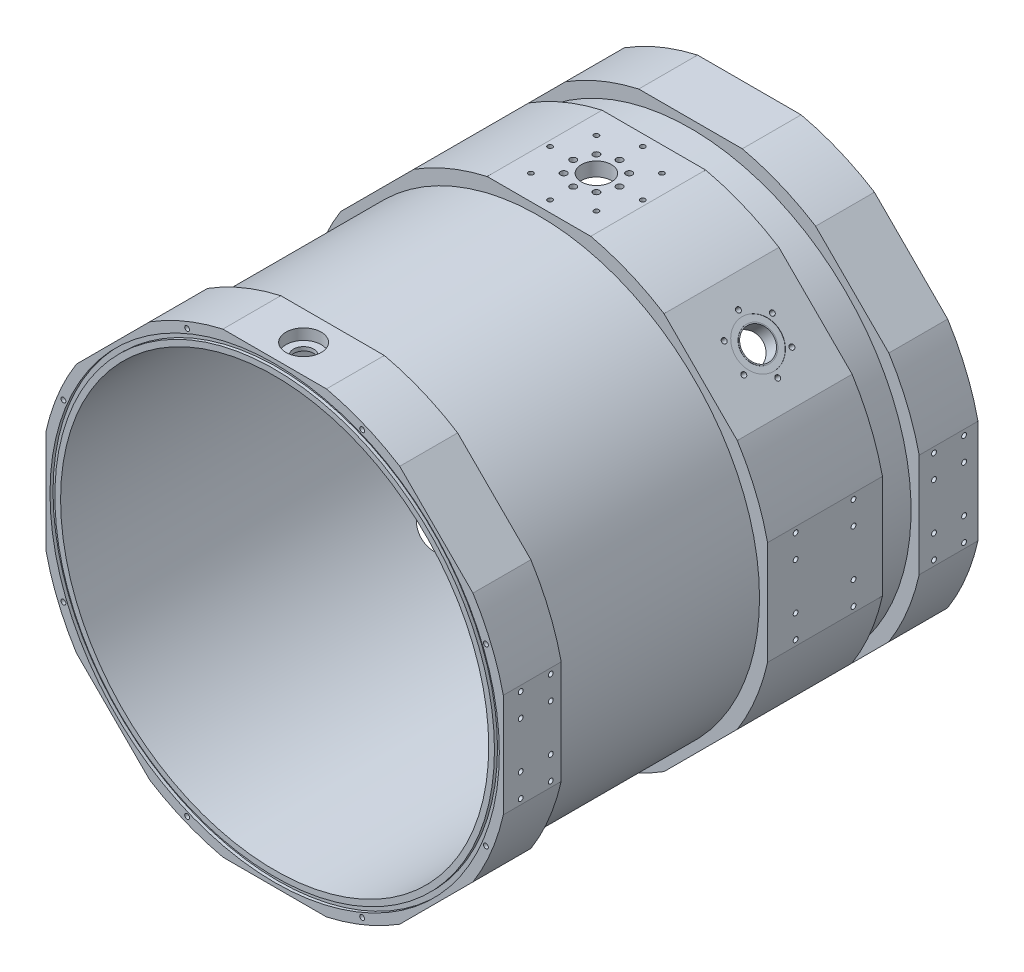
SolidWorks part; units mm, degrees
other "DetailItem1"
other "DetailItem3"
ref_plane "Front Plane" through (0, 0, 0) normal (0, 0, 1) x (1, 0, 0)
ref_plane "Top Plane" through (0, 0, 0) normal (0, 1, 0) x (1, 0, 0)
ref_plane "Right Plane" through (0, 0, 0) normal (1, 0, 0) x (0, 0, -1)
ref_plane "Plane1" through (0, 0, -41.2818) normal (0, 0, 1) x (1, 0, 0)
sketch "Sketch1" plane through (0, 0, 0) normal (0, 0, 1) x (1, 0, 0)
  line L0 (0, 74.0826) -> (0, -98.2025) construction
  line L1 (-101.5333, 0) -> (146.3274, 0) construction
  circle A0 centre (0, 0) radius 202.5
  circle A1 centre (0, 0) radius 184.9
  dimension "D1" = 17.6
  dimension "D2" = 405
extrude "Boss-Extrude1" add sketch "Sketch1" along normal mid plane 410
sketch "Sketch2" plane through (0, 0, 205) normal (0, 0, 1) x (1, 0, 0)
  line L0 (0, 212.952) -> (0, -223.7918) construction
  line L1 (-207.1672, 0) -> (208.5976, 0) construction
  line L2 (197.5, 81.8072) -> (197.5, -81.8072) construction
  line L3 (-197.5, 81.8072) -> (-197.5, -81.8072) construction
  line L4 (-197.5, -81.8072) -> (-81.8072, -197.5) construction
  line L5 (81.8072, -197.5) -> (197.5, -81.8072) construction
  line L6 (81.8072, -197.5) -> (-81.8072, -197.5) construction
  line L7 (-197.5, 81.8072) -> (-81.8072, 197.5) construction
  line L8 (81.8072, 197.5) -> (197.5, 81.8072) construction
  line L9 (81.8072, 197.5) -> (-81.8072, 197.5) construction
  dimension "D1" = 197.5
  dimension "D2" = 197.5
  dimension "D3" = 135
  dimension "D4" = 135
  dimension "D5" = 197.5
sketch "Sketch3" plane through (0, 0, 205) normal (0, 0, 1) x (1, 0, 0)
  line L0 (-44.7214, 197.5) -> (44.7214, 197.5)
  line L1 (108.0308, 171.2764) -> (171.2764, 108.0308)
  line L2 (197.5, 44.7214) -> (197.5, -44.7214)
  line L3 (171.2764, -108.0308) -> (108.0308, -171.2764)
  line L4 (44.7214, -197.5) -> (-44.7214, -197.5)
  line L5 (-108.0308, -171.2764) -> (-171.2764, -108.0308)
  line L6 (-197.5, -44.7214) -> (-197.5, 44.7214)
  line L7 (-171.2764, 108.0308) -> (-108.0308, 171.2764)
  line L9 (-197.5, -81.8072) -> (-81.8072, -197.5) construction
  arc A0 (108.0308, 171.2764) -> (44.7214, 197.5) centre (0, 0) ccw
  arc A1 (-44.7214, 197.5) -> (-108.0308, 171.2764) centre (0, 0) ccw
  arc A2 (-171.2764, 108.0308) -> (-197.5, 44.7214) centre (0, 0) ccw
  arc A3 (-197.5, -44.7214) -> (-171.2764, -108.0308) centre (0, 0) ccw
  arc A4 (-108.0308, -171.2764) -> (-44.7214, -197.5) centre (0, 0) ccw
  arc A5 (44.7214, -197.5) -> (108.0308, -171.2764) centre (0, 0) ccw
  arc A6 (171.2764, -108.0308) -> (197.5, -44.7214) centre (0, 0) ccw
  arc A7 (197.5, 44.7214) -> (171.2764, 108.0308) centre (0, 0) ccw
  dimension "D1" = 405
extrude "Cut-Extrude1" cut sketch "Sketch3" against normal blind 490 flip side to cut
sketch "Sketch4" plane through (0, 0, 205) normal (0, 0, 1) x (1, 0, 0)
  line L1 (81.8072, 197.5) -> (-81.8072, -197.5) construction
  line L2 (81.8072, -197.5) -> (-81.8072, 197.5) construction
  line L3 (197.5, 81.8072) -> (-197.5, -81.8072) construction
  line L4 (-197.5, 81.8072) -> (197.5, -81.8072) construction
  circle A0 centre (0, 0) radius 197.5 construction
  circle A1 centre (-75.58, 182.4662) radius 1.7018
  circle A2 centre (75.58, 182.4662) radius 1.7018
  circle A3 centre (182.4662, 75.58) radius 1.7018
  circle A4 centre (170.1324, -70.4712) radius 1.7018
  circle A5 centre (75.58, -182.4662) radius 1.7018
  circle A6 centre (-75.58, -182.4662) radius 1.7018
  circle A7 centre (-182.4662, 75.58) radius 1.7018
  circle A8 centre (-182.4662, -75.58) radius 1.7018
  circle A9 centre (0, 0) radius 202.5 construction
  dimension "D1" = 3.4036
  dimension "D2" = 5
sketch "Sketch5" plane through (0, 0, 0) normal (0, 1, 0) x (1, 0, 0)
  line L0 (-241.56, 0) -> (278.2282, 0) construction
  line L1 (278.2282, 38.1) -> (-241.56, 38.1) construction
  line L2 (184.9, 33.3375) -> (148.59, 36.5125)
  line L3 (184.9, -205) -> (184.9, 205) construction
  line L4 (148.59, 36.5125) -> (161.29, 36.5125)
  line L5 (161.29, 36.5125) -> (161.29, 39.6875)
  line L6 (161.29, 39.6875) -> (148.59, 39.6875)
  line L7 (148.59, 39.6875) -> (173.99, 42.8625)
  line L8 (173.99, -225.2492) -> (173.99, 235.0092) construction
  line L9 (0, 222.1438) -> (0, -218.5673) construction
  line L10 (184.9, 33.3375) -> (173.99, 42.8625)
  dimension "D1" = 38.1
  dimension "D2" = 3.175
  dimension "D3" = 173.99
  dimension "D4" = 1.5875
  dimension "D5" = 4.7625
  dimension "D6" = 4.7625
  dimension "D7" = 25.4
  dimension "D8" = 12.7
  dimension "D9" = 25.4
sketch "Sketch7" plane through (0, 197.5, 0) normal (0, 1, 0) x (1, 0, 0)
  line L0 (238.7419, 41.2818) -> (-246.5794, 41.2818) construction
  line L1 (0, 219.8326) -> (0, -217.4561) construction
  line L2 (-55, 41.2818) -> (55, 41.2818) construction
  circle A2 centre (0, 41.2818) radius 12.5
  circle A3 centre (0, 41.2818) radius 20 construction
  dimension "D4" = 25
  dimension "D5" = 40
sketch "Sketch8" plane through (0, 197.5, 0) normal (0, 1, 0) x (1, 0, 0)
  line L1 (0, 219.8326) -> (0, -217.4561) construction
  circle A0 centre (0, 61.2818) radius 2.2479
  circle A2 centre (0, 41.2818) radius 20 construction
  dimension "D1" = 4.4958
ref_plane "Plane2" through (0, 0, -179.65) normal (0, 0, -1) x (-1, 0, 0)
sketch "Sketch9" plane through (0, 0, -179.65) normal (0, 0, -1) x (-1, 0, 0)
  circle A0 centre (0, 0) radius 171.9
  circle A1 centre (0, 0) radius 184.9
  circle A2 centre (0, 0) radius 184.9 construction
  dimension "D1" = 13
extrude "Boss-Extrude2" add sketch "Sketch9" along normal blind 15
sketch "Sketch10" plane through (0, 0, -194.65) normal (0, 0, -1) x (-1, 0, 0)
  circle A0 centre (0, 0) radius 176.9 construction
  circle A1 centre (0, 176.9) radius 1.632
  circle A2 centre (0, 0) radius 184.9 construction
  dimension "D1" = 8
  dimension "D2" = 3.2639
ref_plane "Plane3" through (0, 0, 155) normal (0, 0, 1) x (1, 0, 0)
sketch "Sketch11" plane through (0, 0, 155) normal (0, 0, 1) x (1, 0, 0)
  circle A0 centre (0, 0) radius 190.5
  circle A1 centre (0, 0) radius 202.5 construction
  dimension "D1" = 12
extrude "Cut-Extrude7" cut sketch "Sketch11" against normal blind 178.2893 flip side to cut
ref_plane "Plane4" through (0, 0, -154.2) normal (0, 0, -1) x (-1, 0, 0)
sketch "Sketch13" plane through (0, 0, -154.2) normal (0, 0, -1) x (-1, 0, 0)
  circle A0 centre (0, 0) radius 190.5
  circle A1 centre (0, 0) radius 202.5 construction
  dimension "D1" = 12
extrude "Cut-Extrude9" cut sketch "Sketch13" against normal blind 31.7107 flip side to cut
sketch "Sketch17" plane through (0, 197.5, 0) normal (0, 1, 0) x (-1, 0, 0)
  line L0 (0, -92.2113) -> (0, 10.7854) construction
  line L1 (46.1607, -112.9643) -> (-45.5675, -112.9643) construction
  line L2 (-44.7214, -122.4893) -> (44.7214, -122.4893) construction
  dimension "D1" = 9.525
sketch "Sketch20" plane through (-139.6536, 139.6536, 0) normal (-0.7071, 0.7071, 0) x (0, 0, 1)
  line L0 (-213.8582, 0) -> (209.8926, 0) construction
  line L1 (-72.8893, 74.7796) -> (-72.8893, -40.2223) construction
  line L2 (-23.2893, -190.5) -> (-23.2893, 190.5) construction
  line L3 (-122.4893, 190.5) -> (-122.4893, -190.5) construction
  line L4 (-44.0124, -16.6721) -> (-101.7661, 16.6721) construction
  line L5 (-101.7661, -16.6721) -> (-44.0124, 16.6721) construction
  circle A0 centre (-72.8893, 0) radius 13
  circle A1 centre (-72.8893, 0) radius 24.003 construction
  dimension "D1" = 26
  dimension "D4" = 48.006
  dimension "D2" = 30
  dimension "D3" = 30
extrude "Cut-Extrude10" cut sketch "Sketch20" against normal blind 15
sketch "Sketch21" plane through (-139.6536, 139.6536, 0) normal (-0.7071, 0.7071, 0) x (0, 0, 1)
  circle A0 centre (-72.8893, 0) radius 19.304
  circle A1 centre (-72.8893, 0) radius 13.97
  dimension "D1" = 27.94
  dimension "D2" = 5.334
extrude "Cut-Extrude11" cut sketch "Sketch21" against normal blind 0.254
hole_wizard "M5x0.8 Tapped Hole6" positions "3DSketch2" profile "Sketch23" tap size "M5x0.8" standard "Ansi Metric"
sketch3d "3DSketch2"
  line L0 (-86.7765, 192.5307, -72.8893) -> (-168.0951, 111.2121, -72.8893) construction
  line L1 (-151.4425, 127.8647, -101.7661) -> (-127.8647, 151.4425, -44.0124) construction
  line L2 (-151.4425, 127.8647, -44.0124) -> (-127.8647, 151.4425, -101.7661) construction
  circle A0 centre (-139.6536, 139.6536, -72.8893) radius 24.003 construction
  point P0 (-122.6809, 156.6263, -72.8893)
  point P6 (-156.6263, 156.6263, -72.8893)
  point P7 (-148.1399, 131.1672, -93.6765)
  point P11 (-131.1672, 148.1399, -93.6765)
  point P15 (-156.6263, 122.6809, -72.8893)
  point P17 (-148.1399, 131.1672, -93.6765)
  point P19 (-131.1672, 148.1399, -93.6765)
  point P21 (-148.1399, 131.1672, -93.6765)
  point P23 (-131.1672, 148.1399, -93.6765)
  point P31 (-148.1399, 131.1672, -93.6765)
  point P33 (-131.1672, 148.1399, -93.6765)
  point P36 (-131.1672, 148.1399, -93.6765)
  point P38 (-148.1399, 131.1672, -93.6765)
  point P40 (-148.1399, 131.1672, -52.1021)
  point P42 (-131.1672, 148.1399, -52.1021)
sketch "Sketch23" plane through (-122.6809, 156.6263, -72.8893) normal (0, 0, 1) x (-0.7071, -0.7071, 0)
  line L0 (0, 0) -> (0, 8.3738)
  line L1 (0, 8.3738) -> (2.1, 7.112)
  line L2 (2.1, 7.112) -> (2.1, 0)
  line L5 (2.1, 0) -> (0, 0)
  line L10 (0, 8.3738) -> (-2.1, 7.112) construction
  line L11 (0, -6.35) -> (0, 107.95) construction
  dimension "Tap Drill Dia." = 4.2
  dimension "Tap Drill Depth" = 7.112
  dimension "Drill Angle" = 118
mirror "Mirror2" about plane through (0, 0, 0) normal (1, 0, 0) of "M5x0.8 Tapped Hole6", "Cut-Extrude11", "Cut-Extrude10"
sketch "Sketch24" plane through (-139.6536, -139.6536, 0) normal (0.7071, 0.7071, 0) x (0, 0, 1)
  line L0 (-72.8893, 198.5108) -> (-72.8893, -206.1304) construction
  line L1 (-216.7578, 0) -> (226.3825, 0) construction
  line L2 (-23.2893, -190.5) -> (-23.2893, 190.5) construction
  line L3 (-122.4893, -171.2764) -> (-122.4893, -197.5) construction
  circle A0 centre (-72.8893, 0) radius 20.5
  dimension "D1" = 41
extrude "Cut-Extrude12" cut sketch "Sketch24" along normal blind 17
sketch "Sketch25" plane through (-139.6536, -139.6536, 0) normal (0.7071, 0.7071, 0) x (0, 0, 1)
  line L0 (-72.8893, 63.097) -> (-72.8893, -63.629) construction
  line L1 (-93.2399, 0) -> (11.8304, 0) construction
  line L2 (-110.0134, 21.4336) -> (6.9294, -46.0833) construction
  line L3 (0.8647, 42.5818) -> (-102.7952, -17.2662) construction
  circle A0 centre (-72.8893, 0) radius 21.77
  circle A1 centre (-72.8893, 0) radius 27.104
  circle A2 centre (-72.8893, 0) radius 20.5 construction
  circle A3 centre (-72.8893, 0) radius 30.988 construction
  dimension "D1" = 1.27
  dimension "D2" = 5.334
  dimension "D5" = 61.976
  dimension "D3" = 30
  dimension "D4" = 30
extrude "Cut-Extrude13" cut sketch "Sketch25" along normal blind 0.254
hole_wizard "M5x0.8 Tapped Hole7" positions "3DSketch5" profile "Sketch28" tap size "M5x0.8" standard "Ansi Metric"
sketch3d "3DSketch5"
  line L0 (-95.0372, -184.2699, -72.8893) -> (-184.6461, -94.6611, -72.8893) construction
  line L1 (-124.4977, -154.8094, -110.0134) -> (-172.2394, -107.0678, 6.9294) construction
  line L2 (-109.5437, -169.7635, 0.8647) -> (-151.8627, -127.4445, -102.7952) construction
  circle A0 centre (-139.6536, -139.6536, -72.8893) radius 30.988 construction
  point P0 (-161.5654, -117.7418, -72.8893)
  point P6 (-117.7418, -117.7418, -72.8893)
  point P7 (-128.6977, -150.6095, -99.7257)
  point P11 (-150.6095, -128.6977, -99.7257)
  point P15 (-117.7418, -161.5654, -72.8893)
  point P17 (-128.6977, -150.6095, -99.7257)
  point P19 (-150.6095, -128.6977, -99.7257)
  point P20 (-150.6095, -128.6977, -99.7257)
  point P22 (-128.6977, -150.6095, -99.7257)
  point P25 (-150.6095, -128.6977, -99.7257)
  point P27 (-128.6977, -150.6095, -99.7257)
  point P28 (-150.6095, -128.6977, -46.0529)
  point P30 (-128.6977, -150.6095, -46.0529)
sketch "Sketch28" plane through (-161.5654, -117.7418, -72.8893) normal (0, 0, 1) x (0.7071, -0.7071, 0)
  line L0 (0, 0) -> (0, 7.6618)
  line L1 (0, 7.6618) -> (2.1, 6.4)
  line L2 (2.1, 6.4) -> (2.1, 0)
  line L5 (2.1, 0) -> (0, 0)
  line L10 (0, 7.6618) -> (-2.1, 6.4) construction
  line L11 (0, -6.35) -> (0, 107.95) construction
  dimension "Tap Drill Dia." = 4.2
  dimension "Tap Drill Depth" = 6.4
  dimension "Drill Angle" = 118
mirror "Mirror4" about plane through (0, 0, 0) normal (1, 0, 0) of "Cut-Extrude13", "M5x0.8 Tapped Hole7", "Cut-Extrude12"
sketch "Sketch29" plane through (197.5, 0, 0) normal (1, 0, 0) x (0, 0, -1)
  line L0 (-287.3192, 0) -> (319.9172, 0) construction
  line L1 (72.8893, 197.3077) -> (72.8893, -198.5108) construction
  line L2 (122.4893, -44.7214) -> (122.4893, 44.7214) construction
  line L3 (23.2893, 108.0308) -> (23.2893, 44.7214) construction
  line L4 (179.6, 197.3077) -> (179.6, -198.5108) construction
  line L5 (-180, 194.5005) -> (-180, -201.318) construction
  line L6 (205, -44.7214) -> (205, 44.7214) construction
  line L7 (154.2, -44.7214) -> (154.2, 44.7214) construction
  line L8 (-205, -44.7214) -> (-205, 44.7214) construction
  line L9 (-155, 44.7214) -> (-155, -44.7214) construction
  line L10 (-313.7208, 20) -> (327.2198, 20) construction
  line L11 (327.2198, -20) -> (-287.3192, -20) construction
  line L12 (-295.1835, 40) -> (278.9105, 40) construction
  line L13 (319.9172, -40) -> (-303.6096, -40) construction
  line L14 (193, 197.3077) -> (193, -195.3025) construction
  line L15 (167, 197.3077) -> (167, -198.5108) construction
  line L16 (97.4893, 191.2922) -> (97.4893, -201.318) construction
  line L17 (47.4893, 191.2922) -> (47.4893, -201.318) construction
  line L18 (205, 44.7214) -> (205, 108.0308) construction
  line L19 (-164, 194.5005) -> (-164, -198.5108) construction
  line L20 (-190, 194.5005) -> (-190, -198.5108) construction
  line L21 (122.4893, 44.7214) -> (122.4893, 108.0308) construction
  line L22 (-205, 108.0308) -> (-205, 171.2764) construction
  dimension "D1" = 20
  dimension "D2" = 20
  dimension "D3" = 20
  dimension "D4" = 20
  dimension "D5" = 25
  dimension "D6" = 50
  dimension "D7" = 12
  dimension "D8" = 26
  dimension "D9" = 15
  dimension "D10" = 26
hole_wizard "M5x0.8 Tapped Hole2" positions "3DSketch6" profile "Sketch30" tap size "M5x0.8" standard "Ansi Metric"
sketch3d "3DSketch6"
  line L0 (197.5, 40, 295.1835) -> (197.5, 40, -278.9105) construction
  line L1 (197.5, 197.3077, -193) -> (197.5, -195.3025, -193) construction
  line L2 (197.5, -40, -319.9172) -> (197.5, -40, 303.6096) construction
  line L3 (197.5, 197.3077, -167) -> (197.5, -198.5108, -167) construction
  line L4 (197.5, 191.2922, -97.4893) -> (197.5, -201.318, -97.4893) construction
  line L5 (197.5, 191.2922, -47.4893) -> (197.5, -201.318, -47.4893) construction
  line L6 (197.5, 194.5005, 164) -> (197.5, -198.5108, 164) construction
  line L7 (197.5, 194.5005, 190) -> (197.5, -198.5108, 190) construction
  line L8 (197.5, 20, 313.7208) -> (197.5, 20, -327.2198) construction
  line L9 (197.5, -20, -327.2198) -> (197.5, -20, 287.3192) construction
  point P0 (197.5, 40, -193)
  point P6 (197.5, 1.0026, -193)
  point P8 (197.5, -40, -193)
  point P14 (197.5, 40, -167)
  point P18 (197.5, 40, -97.4893)
  point P22 (197.5, -40, -97.4893)
  point P26 (197.5, 40, -47.4893)
  point P32 (197.5, -40, 164)
  point P38 (197.5, 40, 190)
  point P42 (197.5, 20, -97.4893)
  point P46 (197.5, -20, -97.4893)
  point P50 (197.5, -20, -47.4893)
  point P52 (197.5, 20, -47.4893)
  point P54 (197.5, 20, -167)
  point P56 (197.5, 20, -193)
  point P58 (197.5, -20, -193)
  point P60 (197.5, -20, -167)
  point P62 (197.5, -20, 164)
  point P64 (197.5, -20, 190)
  point P66 (197.5, 20, 190)
  point P68 (197.5, 20, 164)
  point P73 (197.5, -40, -167)
  point P76 (197.5, 40, 164)
  point P78 (197.5, -40, 190)
  point P82 (197.5, -40, -47.4893)
sketch "Sketch30" plane through (197.5, 40, -193) normal (0, 1, 0) x (0, 0, -1)
  line L0 (0, 0) -> (0, 9.3898)
  line L1 (0, 9.3898) -> (2.1, 8.128)
  line L2 (2.1, 8.128) -> (2.1, 0)
  line L5 (2.1, 0) -> (0, 0)
  line L10 (0, 9.3898) -> (-2.1, 8.128) construction
  line L11 (0, -6.35) -> (0, 107.95) construction
  dimension "Tap Drill Dia." = 4.2
  dimension "Tap Drill Depth" = 8.128
  dimension "Drill Angle" = 118
mirror "Mirror5" [suppressed] about plane through (0, 0, 0) normal (1, 0, 0)
sketch "Sketch31" plane through (0, -197.5, 0) normal (0, -1, 0) x (1, 0, 0)
  line L0 (-208.054, -72.8893) -> (237.5383, -72.8893) construction
  line L1 (0, 223.9363) -> (0, -225.4604) construction
  line L2 (44.7214, -23.2893) -> (-44.7214, -23.2893) construction
  line L3 (-44.7214, -122.4893) -> (44.7214, -122.4893) construction
  circle A0 centre (0, -72.8893) radius 20.5
  dimension "D1" = 41
extrude "Cut-Extrude14" cut sketch "Sketch31" against normal blind 17
sketch "Sketch33" plane through (0, -197.5, 0) normal (0, -1, 0) x (1, 0, 0)
  line L0 (0, -83.3724) -> (0, 2.1897) construction
  line L1 (-35.2472, -72.8893) -> (34.8136, -72.8893) construction
  line L2 (15.7139, -45.6721) -> (-15.7139, -100.1065) construction
  line L4 (-64.2452, 38.3867) -> (64.2452, -184.1652) construction
  circle A0 centre (0, -72.8893) radius 21.77
  circle A1 centre (0, -72.8893) radius 27.104
  circle A2 centre (0, -72.8893) radius 20.5 construction
  circle A3 centre (0, -72.8893) radius 30.988 construction
  dimension "D1" = 1.27
  dimension "D2" = 5.334
  dimension "D3" = 61.976
  dimension "D4" = 30
  dimension "D5" = 30
extrude "Cut-Extrude15" cut sketch "Sketch33" against normal blind 0.254
hole_wizard "M5x0.8 Tapped Hole8" positions "3DSketch7" profile "Sketch34" tap size "M5x0.8" standard "Ansi Metric"
sketch3d "3DSketch7"
  line L0 (-35.2472, -197.5, -72.8893) -> (34.8136, -197.5, -72.8893) construction
  line L1 (-64.2452, -197.5, 38.3867) -> (64.2452, -197.5, -184.1652) construction
  line L2 (15.7139, -197.5, -45.6721) -> (-15.7139, -197.5, -100.1065) construction
  circle A0 centre (0, -197.5, -72.8893) radius 30.988 construction
  point P0 (-30.988, -197.5, -72.8893)
  point P6 (0, -228.488, -72.8893)
  point P7 (15.494, -197.5, -99.7257)
  point P11 (-15.494, -197.5, -99.7257)
  point P15 (30.988, -197.5, -72.8893)
  point P17 (15.494, -197.5, -99.7257)
  point P19 (-15.494, -197.5, -99.7257)
  point P20 (15.494, -197.5, -99.7257)
  point P22 (-15.494, -197.5, -99.7257)
  point P25 (15.494, -197.5, -99.7257)
  point P27 (-15.494, -197.5, -99.7257)
  point P28 (-15.494, -197.5, -46.0529)
  point P30 (15.494, -197.5, -46.0529)
sketch "Sketch34" plane through (-30.988, -197.5, -72.8893) normal (1, 0, 0) x (0, 0, -1)
  line L0 (0, 0) -> (0, 7.6618)
  line L1 (0, 7.6618) -> (2.1, 6.4)
  line L2 (2.1, 6.4) -> (2.1, 0)
  line L5 (2.1, 0) -> (0, 0)
  line L10 (0, 7.6618) -> (-2.1, 6.4) construction
  line L11 (0, -6.35) -> (0, 107.95) construction
  dimension "Tap Drill Dia." = 4.2
  dimension "Tap Drill Depth" = 6.4
  dimension "Drill Angle" = 118
ref_plane "Plane5" through (0, 185.5, 0) normal (0, 1, 0) x (-1, 0, 0)
sketch "Sketch36" plane through (0, 185.5, 0) normal (0, 1, 0) x (-1, 0, 0)
  line L1 (0, 227.1615) -> (0, -246.9915) construction
  line L2 (-201.8869, -72.8893) -> (201.8869, -72.8893) construction
  line L3 (44.7214, -23.2893) -> (-44.7214, -23.2893) construction
  line L4 (-44.7214, -122.4893) -> (44.7214, -122.4893) construction
  circle A2 centre (0, -72.8893) radius 31.75
  dimension "D1" = 63.5
extrude "Cut-Extrude16" cut sketch "Sketch36" against normal blind 20
hole_wizard "CBORE for M5 Hex Head Bolt1" positions "3DSketch13" profile "Sketch43" counterbore size "M5" standard "Ansi Metric"
sketch3d "3DSketch13"
  point P0 (0, 176.9, -194.65)
sketch "Sketch43" plane through (0, 176.9, -194.65) normal (1, 0, 0) x (0, 1, 0)
  line L0 (0, 0) -> (0, 399.65)
  line L1 (0, 399.65) -> (2.65, 399.65)
  line L3 (2.65, 399.65) -> (2.65, 3.58)
  line L4 (2.65, 3.58) -> (6.12, 3.58)
  line L5 (6.12, 3.58) -> (6.12, 0)
  line L7 (6.12, 0) -> (0, 0)
  line L11 (0, -6.35) -> (0, 107.95) construction
  dimension "Thru Hole Dia." = 5.3
  dimension "Thru Hole Depth" = 399.65
  dimension "C'Bore Dia." = 12.24
  dimension "C'Bore Depth" = 3.58
pattern_circular "CirPattern4" count 16 over 360 about axis through (0, 0, 0) along (0, 0, 1) of "CBORE for M5 Hex Head Bolt1"
hole_wizard "M5x0.8 Tapped Hole4" positions "3DSketch14" profile "Sketch44" tap size "M5x0.8" standard "Ansi Metric"
sketch3d "3DSketch14"
  point P0 (75.58, 182.4662, 205)
sketch "Sketch44" plane through (75.58, 182.4662, 205) normal (1, 0, 0) x (0, -1, 0)
  line L0 (0, 0) -> (0, 13.6618)
  line L1 (0, 13.6618) -> (2.1, 12.4)
  line L2 (2.1, 12.4) -> (2.1, 0)
  line L5 (2.1, 0) -> (0, 0)
  line L10 (0, 13.6618) -> (-2.1, 12.4) construction
  line L11 (0, -6.35) -> (0, 107.95) construction
  dimension "Tap Drill Dia." = 4.2
  dimension "Tap Drill Depth" = 12.4
  dimension "Drill Angle" = 118
pattern_circular "CirPattern5" count 8 over 360 about axis through (0, 0, 0) along (0, 0, 1) of "M5x0.8 Tapped Hole4"
sketch "Sketch45" plane through (0, 0, -205) normal (0, 0, -1) x (-1, 0, 0)
  circle A0 centre (75.58, 182.4662) radius 1.5
  dimension "D1" = 3
hole_wizard "M5x0.8 Tapped Hole3" positions "3DSketch15" profile "Sketch46" tap size "M5x0.8" standard "Ansi Metric"
sketch3d "3DSketch15"
  point P0 (-75.58, 182.4662, -205)
sketch "Sketch46" plane through (-75.58, 182.4662, -205) normal (1, 0, 0) x (0, 1, 0)
  line L0 (0, 0) -> (0, 13.6618)
  line L1 (0, 13.6618) -> (2.1, 12.4)
  line L2 (2.1, 12.4) -> (2.1, 0)
  line L5 (2.1, 0) -> (0, 0)
  line L10 (0, 13.6618) -> (-2.1, 12.4) construction
  line L11 (0, -6.35) -> (0, 107.95) construction
  dimension "Tap Drill Dia." = 4.2
  dimension "Tap Drill Depth" = 12.4
  dimension "Drill Angle" = 118
pattern_circular "CirPattern6" count 8 over 360 about axis through (0, 0, 0) along (0, 0, 1) of "M5x0.8 Tapped Hole3"
sketch "o_ring_groove" plane through (0, 0, 205) normal (0, 0, 1) x (1, 0, 0)
  circle A0 centre (0, 0) radius 194.056
  circle A1 centre (0, 0) radius 189.865
  dimension "D1" = 388.112
  dimension "D2" = 379.73
extrude "Cut-Extrude17" cut sketch "o_ring_groove" against normal blind 2.6162
mirror "Mirror6" about plane through (0, 0, 0) normal (0, 0, 1) of "Cut-Extrude17"
sketch "Sketch53" plane through (0, 197.5, 0) normal (0, 1, 0) x (1, 0, 0)
  line L0 (-209.8054, -180) -> (237.8428, -180) construction
  line L1 (0, 0) -> (0, -246.6393) construction
  line L2 (-44.7214, -155) -> (44.7214, -155) construction
  line L3 (44.7214, -205) -> (-44.7214, -205) construction
  circle A0 centre (0, -180) radius 10 construction
  dimension "D1" = 20
sketch "Sketch56" plane through (0, 197.5, 0) normal (0, 1, 0) x (-1, 0, 0)
  line L0 (212.7439, -72.8893) -> (-219.7107, -72.8893) construction
  line L1 (0, 222.877) -> (0, -215.7291) construction
  line L2 (0, 0) -> (0, 246.6393) construction
  line L3 (-44.7214, -122.4893) -> (44.7214, -122.4893) construction
  line L4 (44.7214, -23.2893) -> (-44.7214, -23.2893) construction
  line L5 (23.6926, -49.1967) -> (-23.6926, -96.5818) construction
  line L6 (71.0994, -143.9887) -> (-71.0994, -1.7898) construction
  circle A0 centre (0, -72.8893) radius 40
  circle A1 centre (0, -72.8893) radius 20
  dimension "D1" = 80
  dimension "D2" = 40
  dimension "D3" = 45
  dimension "D4" = 45
hole_wizard "M25 Clearance Hole5" positions "3DSketch21" profile "Sketch57" hole size "M25" standard "Ansi Metric"
sketch3d "3DSketch21"
  point P0 (0, 197.5, -72.8893)
sketch "Sketch57" plane through (0, 197.5, -72.8893) normal (1, 0, 0) x (0, 0, 1)
  line L0 (0, 0) -> (0, 33.2112)
  line L1 (0, 33.2112) -> (13, 25.4)
  line L2 (13, 25.4) -> (13, 0)
  line L5 (13, 0) -> (0, 0)
  line L10 (0, 33.2112) -> (-13, 25.4) construction
  line L11 (0, -6.35) -> (0, 107.95) construction
  dimension "Hole Dia." = 26
  dimension "Hole Depth" = 25.4
  dimension "Drill Angle" = 118
hole_wizard "M5 Clearance Hole1" positions "3DSketch23" profile "Sketch59" hole size "M5" standard "Ansi Metric"
sketch3d "3DSketch23"
  line L0 (-212.7439, 197.5, -72.8893) -> (219.7107, 197.5, -72.8893) construction
  circle A0 centre (0, 197.5, -72.8893) radius 20 construction
  point P0 (-20, 197.5, -72.8893)
  point P4 (0, 217.5, -72.8893)
sketch "Sketch59" plane through (-20, 197.5, -72.8893) normal (1, 0, 0) x (0, 0, 1)
  line L0 (0, 0) -> (0, 27.0524)
  line L1 (0, 27.0524) -> (2.75, 25.4)
  line L2 (2.75, 25.4) -> (2.75, 0)
  line L5 (2.75, 0) -> (0, 0)
  line L10 (0, 27.0524) -> (-2.75, 25.4) construction
  line L11 (0, -6.35) -> (0, 107.95) construction
  dimension "Hole Dia." = 5.5
  dimension "Hole Depth" = 25.4
  dimension "Drill Angle" = 118
hole_wizard "M5x0.8 Tapped Hole5" positions "3DSketch24" profile "Sketch60" tap size "M5x0.8" standard "Ansi Metric"
sketch3d "3DSketch24"
  line L0 (-212.7439, 197.5, -72.8893) -> (219.7107, 197.5, -72.8893) construction
  circle A0 centre (0, 197.5, -72.8893) radius 40 construction
  point P0 (-40, 197.5, -72.8893)
  point P4 (0, 237.5, -72.8893)
sketch "Sketch60" plane through (-40, 197.5, -72.8893) normal (1, 0, 0) x (0, 0, 1)
  line L0 (0, 0) -> (0, 8.3738)
  line L1 (0, 8.3738) -> (2.1, 7.112)
  line L2 (2.1, 7.112) -> (2.1, 0)
  line L5 (2.1, 0) -> (0, 0)
  line L10 (0, 8.3738) -> (-2.1, 7.112) construction
  line L11 (0, -6.35) -> (0, 107.95) construction
  dimension "Tap Drill Dia." = 4.2
  dimension "Tap Drill Depth" = 7.112
  dimension "Drill Angle" = 118
pattern_circular "CirPattern11" count 8 over 360 about axis through (0, 0, -72.8893) along (0, 1, 0) of "M5x0.8 Tapped Hole5", "M5 Clearance Hole1"
sketch "Sketch61" plane through (0, 197.5, 0) normal (0, 1, 0) x (-1, 0, 0)
  circle A0 centre (0, 180) radius 8.7249
  dimension "D1" = 17.4498
extrude "Cut-Extrude18" cut sketch "Sketch61" against normal blind 20
fillet "Fillet1" [suppressed] radius 2.5
sketch "Sketch62" plane through (0, 0, -179.65) normal (0, 0, 1) x (1, 0, 0)
  circle A0 centre (0, 0) radius 182.118
  dimension "D1" = 364.236
extrude "Cut-Extrude19" cut sketch "Sketch62" against normal blind 0.762
sketch "Sketch63" plane through (0, 197.5, 0) normal (0, 1, 0) x (1, 0, 0)
  circle A0 centre (0, -180) radius 15.24
  circle A1 centre (0, -180) radius 8.7249 construction
  dimension "D1" = 30.48
extrude "Cut-Extrude20" cut sketch "Sketch63" against normal blind 9.398
mirror "Mirror7" about plane through (0, 0, 0) normal (1, 0, 0) of "M5x0.8 Tapped Hole2"
ref_plane "center plane" through (0, 0, -0.0034) normal (0, 0, 1) x (1, 0, 0)
